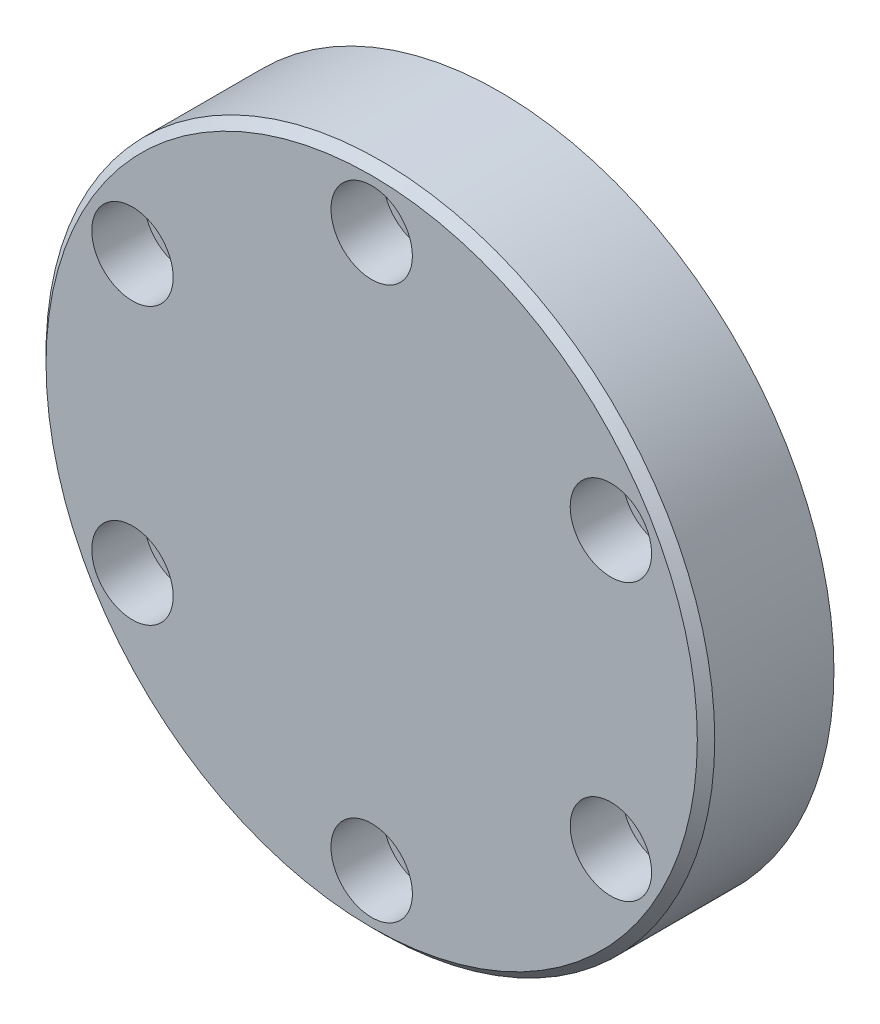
SolidWorks part; units mm, degrees
ref_plane "前视基准面" through (0, 0, 0) normal (0, 0, 1) x (1, 0, 0)
ref_plane "上视基准面" through (0, 0, 0) normal (0, 1, 0) x (1, 0, 0)
ref_plane "右视基准面" through (0, 0, 0) normal (1, 0, 0) x (0, 0, -1)
sketch "草图1" plane through (0, 0, 0) normal (0, 0, 1) x (1, 0, 0)
  circle A0 centre (0, 0) radius 57.5
  dimension "D1" = 115
extrude "拉伸1" add sketch "草图1" along normal mid plane 22
chamfer "倒角1" distance 1.5 angle 45 1 edges at (57.5, 0, 11)
sketch "草图2" plane through (0, 0, -11) normal (0, 0, -1) x (-1, 0, 0)
  circle A0 centre (0, 0) radius 32.5
  dimension "D1" = 65
extrude "切除-拉伸1" cut sketch "草图2" against normal blind 1
sketch "草图3" plane through (0, 0, 11) normal (0, 0, 1) x (1, 0, 0)
  circle A0 centre (0, 47.5) radius 4.5
  dimension "D1" = 9
  dimension "D2" = 47.5
extrude "切除-拉伸2" cut sketch "草图3" against normal through all
sketch "草图4" plane through (0, 0, 11) normal (0, 0, 1) x (1, 0, 0)
  circle A0 centre (0, 47.5) radius 7
  circle A1 centre (0, 47.5) radius 4.5 construction
  dimension "D1" = 14
extrude "切除-拉伸3" cut sketch "草图4" against normal blind 9
pattern_circular "阵列(圆周)1" count 6 over 360 about axis through (0, 0, 0) along (0, 0, 1) of "切除-拉伸3", "切除-拉伸2"
sketch "草图6" plane through (0, 0, 0) normal (0, 1, 0) x (1, 0, 0)
  line L0 (-57.5, 0) -> (53.4093, 0) construction
  line L1 (47.5, 0) -> (-57.5, 0)
  line L2 (-57.5, 0) -> (-64.5275, 0) construction
  line L3 (-42.5, 5) -> (-18.366, 5)
  line L4 (-18.366, 5) -> (-17.5, 3.5)
  line L5 (-17.5, 3.5) -> (47.5, 3.5)
  line L6 (47.5, 3.5) -> (47.5, 0)
  line L7 (-42.5, 5) -> (-42.5, 6.0312)
  line L8 (-42.5, 6.0312) -> (-57.5, 6.5)
  line L9 (-57.5, 11) -> (-57.5, -9.5) construction
  line L10 (-57.5, 6.5) -> (-57.5, 0)
  point P6 (-49.5, 6.25)
  dimension "D1" = 7
  dimension "D2" = 10
  dimension "D3" = 60
  dimension "D4" = 40
  dimension "D5" = 47.5
  dimension "D6" = 15
  dimension "D7" = 13
  dimension "D8" = 8
  dimension "D9" = 12.5
revolve "NPT4/1" cut sketch "草图6" angle 360 about L0
sketch "草图7" plane through (0, 0, -11) normal (0, 0, -1) x (-1, 0, 0)
  circle A0 centre (32.5, 0) radius 3.5
  circle A1 centre (0, 0) radius 32.5 construction
  dimension "D1" = 7
extrude "切除-拉伸4" cut sketch "草图7" against normal up to surface (6 mm away)
ref_plane "基准面1" through (47.5, 0, 0) normal (1, 0, 0) x (0, 0, -1)
sketch "草图8" plane through (47.5, 0, 0) normal (1, 0, 0) x (0, 0, -1)
  line L0 (0, 0) -> (26.7658, 0) construction
  line L1 (11, 0) -> (11, 3.5)
  line L2 (11, -57.5) -> (11, 57.5) construction
  line L3 (11, 3.5) -> (-4, 3.5)
  line L4 (-4, 3.5) -> (-6.0207, 0)
  line L5 (-6.0207, 0) -> (11, 0)
  dimension "D1" = 7
  dimension "D2" = 60
  dimension "D3" = 15
revolve "切除-旋转1" cut sketch "草图8" angle 360 about L0
chamfer "倒角2" distance 1 angle 45 1 edges at (-57.2314, 5.5511, 3.3655)
sketch "草图9" plane through (0, 0, 0) normal (1, 0, 0) x (0, 0, -1)
  line L0 (26.8747, 0) -> (-19.9837, 0)
extrude "切除-拉伸5" cut sketch "草图9" against normal through all and the other way through all
